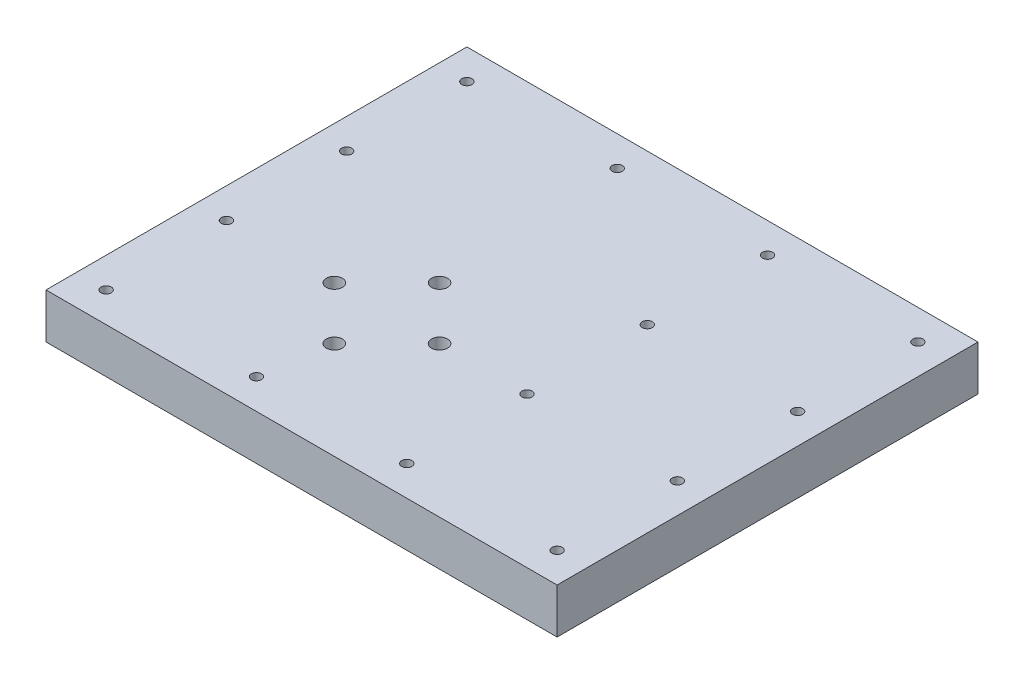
SolidWorks part; units mm, degrees
ref_plane "Front Plane" through (0, 0, 0) normal (0, 0, 1) x (1, 0, 0)
ref_plane "Top Plane" through (0, 0, 0) normal (0, 1, 0) x (1, 0, 0)
ref_plane "Right Plane" through (0, 0, 0) normal (1, 0, 0) x (0, 0, -1)
sketch "Sketch1" plane through (0, 0, 0) normal (0, 1, 0) x (1, 0, 0)
  line L1 (-107.95, 88.9) -> (107.95, 88.9)
  line L2 (-107.95, 88.9) -> (-107.95, -88.9)
  line L3 (-107.95, -88.9) -> (107.95, -88.9)
  line L4 (107.95, 88.9) -> (107.95, -88.9)
  line L5 (-107.95, 88.9) -> (107.95, -88.9) construction
  line L6 (-107.95, -88.9) -> (107.95, 88.9) construction
  point P0 (0, 0)
  dimension "D1" = 177.8
  dimension "D2" = 215.9
extrude "Boss-Extrude1" add sketch "Sketch1" along normal blind 19.05
sketch "Sketch2" plane through (0, 19.05, 0) normal (0, 1, 0) x (1, 0, 0)
  line L0 (-107.95, 88.9) -> (-107.95, -88.9) construction
  line L1 (-107.95, -88.9) -> (107.95, -88.9) construction
  line L2 (-27.432, 8.166) -> (-27.432, -56.3477) construction
  line L3 (-62.1566, -25.4) -> (26.0922, -25.4) construction
  circle A0 centre (-27.432, -25.4) radius 22.225 construction
  circle A2 centre (-27.432, -3.175) radius 3.3782
  circle A3 centre (-49.657, -25.4) radius 3.3782
  circle A4 centre (-27.432, -47.625) radius 3.3782
  circle A5 centre (-5.207, -25.4) radius 3.3782
  dimension "D1" = 44.45
  dimension "D4" = 6.7564
  dimension "D5" = 6.7564
  dimension "D6" = 6.7564
  dimension "D7" = 6.7564
  dimension "D2" = 80.518
  dimension "D3" = 63.5
extrude "Cut-Extrude1" cut sketch "Sketch2" against normal through all and the other way through all
sketch "Sketch3" plane through (0, 0, 0) normal (0, 1, 0) x (1, 0, 0)
  line L0 (-107.95, 88.9) -> (-107.95, -88.9) construction
  line L1 (107.95, 88.9) -> (-107.95, 88.9) construction
  circle A0 centre (-95.25, 76.2) radius 3.175 construction
  circle A1 centre (-31.75, 76.2) radius 3.175 construction
  circle A2 centre (31.75, 76.2) radius 3.175 construction
  circle A3 centre (95.25, 76.2) radius 3.175 construction
  circle A4 centre (-31.75, 76.2) radius 3.175 construction
  circle A5 centre (31.75, 76.2) radius 3.175 construction
  circle A6 centre (95.25, 76.2) radius 3.175 construction
  circle A7 centre (-31.75, 25.4) radius 3.175 construction
  circle A8 centre (31.75, 25.4) radius 3.175 construction
  circle A9 centre (95.25, 25.4) radius 3.175 construction
  circle A11 centre (31.75, -25.4) radius 3.175 construction
  circle A12 centre (95.25, -25.4) radius 3.175 construction
  circle A13 centre (-31.75, -76.2) radius 3.175 construction
  circle A14 centre (31.75, -76.2) radius 3.175 construction
  circle A15 centre (95.25, -76.2) radius 3.175 construction
  circle A16 centre (-95.25, 25.4) radius 3.175 construction
  circle A17 centre (-95.25, -25.4) radius 3.175 construction
  circle A18 centre (-95.25, -76.2) radius 3.175 construction
  circle A19 centre (-31.75, -25.4) radius 3.175 construction
  dimension "D1" = 6.35
  dimension "D2" = 12.7
  dimension "D3" = 12.7
  dimension "D5" = 4
  dimension "D4" = 4
  dimension "D6" = 4
hole_wizard "CBORE for #8 Binding Head Machine Screw1" positions "Sketch6" profile "Sketch7" counterbore size "#8" standard "ANSI Inch"
sketch "Sketch6" plane through (0, 0, 0) normal (0, -1, 0) x (-1, 0, 0)
  point P0 (-95.25, 76.2)
  point P3 (-95.25, 25.4)
  point P6 (-31.75, 25.4)
  point P9 (-31.75, 76.2)
  point P12 (31.75, 76.2)
  point P15 (95.25, 76.2)
  point P21 (95.25, 25.4)
  point P24 (95.25, -25.4)
  point P27 (-31.75, -25.4)
  point P30 (-95.25, -25.4)
  point P33 (-95.25, -76.2)
  point P36 (-31.75, -76.2)
  point P39 (31.75, -76.2)
  point P42 (95.25, -76.2)
sketch "Sketch7" plane through (95.25, 0, -76.2) normal (1, 0, 0) x (0, 0, -1)
  line L0 (0, 0) -> (0, 19.05)
  line L1 (0, 19.05) -> (2.1526, 19.05)
  line L3 (2.1526, 19.05) -> (2.1527, 4.4196)
  line L4 (2.1527, 4.4196) -> (3.9687, 4.4196)
  line L5 (3.9687, 4.4196) -> (3.9687, 0)
  line L7 (3.9687, 0) -> (0, 0)
  line L11 (0, -6.35) -> (0, 107.95) construction
  dimension "Thru Hole Dia." = 4.3053
  dimension "Thru Hole Depth" = 19.05
  dimension "C'Bore Dia." = 7.9375
  dimension "C'Bore Depth" = 4.4196
